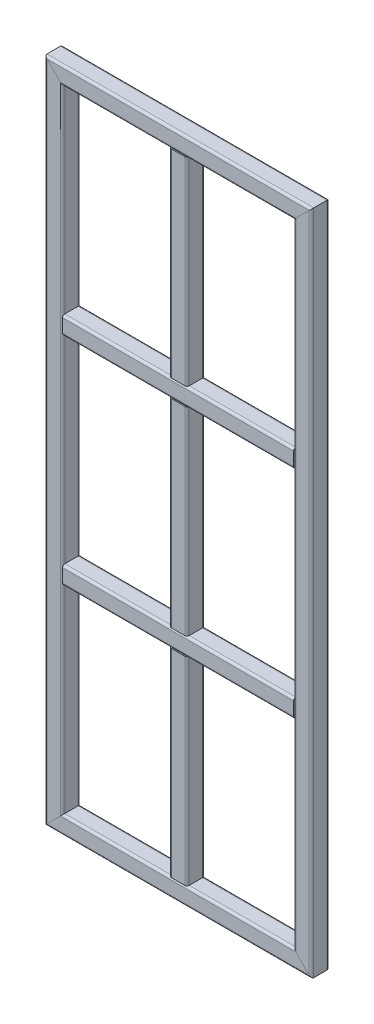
SolidWorks part; units mm, degrees
ref_plane "Płaszczyzna przednia" through (0, 0, 0) normal (0, 0, 1) x (1, 0, 0)
ref_plane "Płaszczyzna górna" through (0, 0, 0) normal (0, 1, 0) x (1, 0, 0)
ref_plane "Płaszczyzna prawa" through (0, 0, 0) normal (1, 0, 0) x (0, 0, -1)
sketch "Szkic1" plane through (0, 0, 0) normal (0, 0, 1) x (1, 0, 0)
  line L0 (-1200, -1460) -> (-1200, 1460) construction
  line L1 (-80, 1460) -> (-1200, 1460) construction
  line L2 (-80, -1460) -> (-80, 1460) construction
  line L3 (-80, -1460) -> (-1200, -1460) construction
  line L4 (-1200, -1460) -> (-1200, 1460)
  line L5 (-80, 1460) -> (-1200, 1460)
  line L6 (-80, -1460) -> (-80, 1460)
  line L7 (-80, -1460) -> (-1200, -1460)
  line L8 (-1200, 486.6667) -> (-80, 486.6667)
  line L9 (-1200, -486.6667) -> (-80, -486.6667)
  line L10 (-640, 1460) -> (-640, 486.6667)
  line L11 (-640, 486.6667) -> (-640, -486.6667)
  line L12 (-640, -486.6667) -> (-640, -1460)
other "Człon konstrukcyjny1"
ref_plane "Płaszczyzna1" through (-80, 1460, 0) normal (-1, 0, 0) x (0, -1, 0)
sketch "Sketch1" plane through (-80, 1460, 0) normal (-1, 0, 0) x (0, -1, 0)
  line L0 (-30, -35) -> (30, -35)
  line L1 (-35, -30) -> (-35, 30)
  line L2 (30, 35) -> (-30, 35)
  line L3 (35, 30) -> (35, -30)
  line L4 (-30, -40) -> (30, -40)
  line L5 (-40, -30) -> (-40, 30)
  line L6 (30, 40) -> (-30, 40)
  line L7 (40, 30) -> (40, -30)
  arc A0 (40, 30) -> (30, 40) centre (30, 30) ccw
  arc A1 (30, -40) -> (40, -30) centre (30, -30) ccw
  arc A2 (-40, -30) -> (-30, -40) centre (-30, -30) ccw
  arc A3 (-30, 40) -> (-40, 30) centre (-30, 30) ccw
  arc A4 (-30, 35) -> (-35, 30) centre (-30, 30) ccw
  arc A5 (35, 30) -> (30, 35) centre (30, 30) ccw
  arc A6 (30, -35) -> (35, -30) centre (30, -30) ccw
  arc A7 (-35, -30) -> (-30, -35) centre (-30, -30) ccw
  point P0 (-40, 0)
  point P1 (40, 0)
  point P2 (0, 40)
  point P3 (0, -40)
  point P4 (0, 0)
  point P5 (-40, -40)
  point P6 (40, -40)
  point P7 (40, 40)
  point P8 (-40, 40)
  point P33 (0, 0)
  dimension "D1" = 10
  dimension "Thickness" = 5
  dimension "V_leg" = 80
